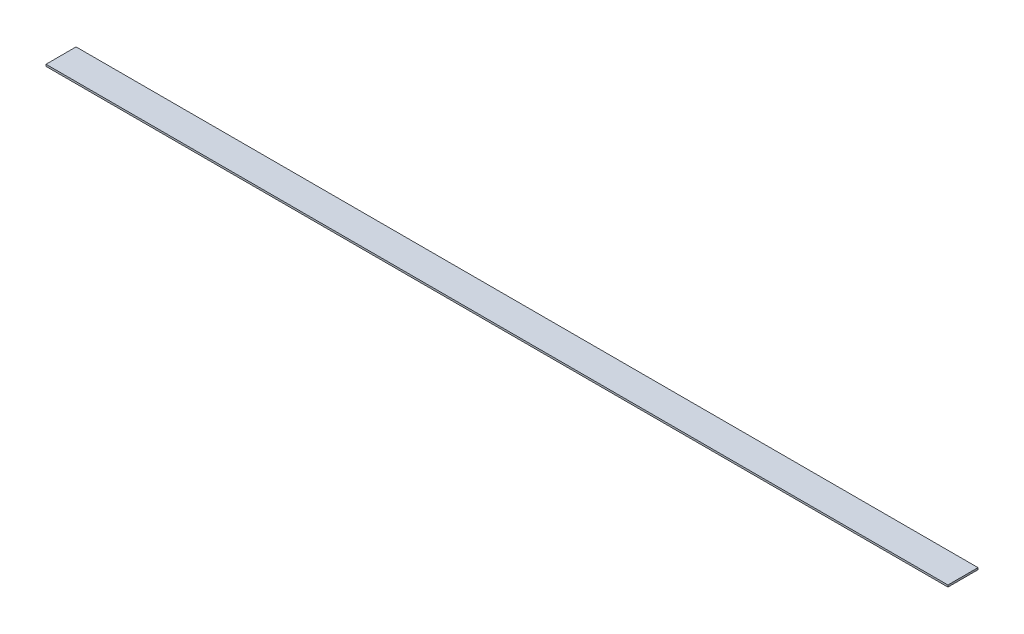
SolidWorks part; units mm, degrees
ref_plane "FRONT" through (0, 0, 0) normal (0, 0, 1) x (1, 0, 0)
ref_plane "TOP" through (0, 0, 0) normal (0, 1, 0) x (1, 0, 0)
ref_plane "RIGHT" through (0, 0, 0) normal (1, 0, 0) x (0, 0, -1)
sketch "Sketch1" plane through (0, 0, 0) normal (0, 1, 0) x (1, 0, 0)
  line L1 (-1524, 50.8) -> (1524, 50.8)
  line L2 (-1524, 50.8) -> (-1524, -50.8)
  line L3 (-1524, -50.8) -> (1524, -50.8)
  line L4 (1524, 50.8) -> (1524, -50.8)
  line L5 (-1524, 50.8) -> (1524, -50.8) construction
  line L6 (-1524, -50.8) -> (1524, 50.8) construction
  point P0 (0, 0)
  dimension "D1" = 3048
  dimension "D2" = 101.6
extrude "Boss-Extrude1" add sketch "Sketch1" along normal blind 6.35
